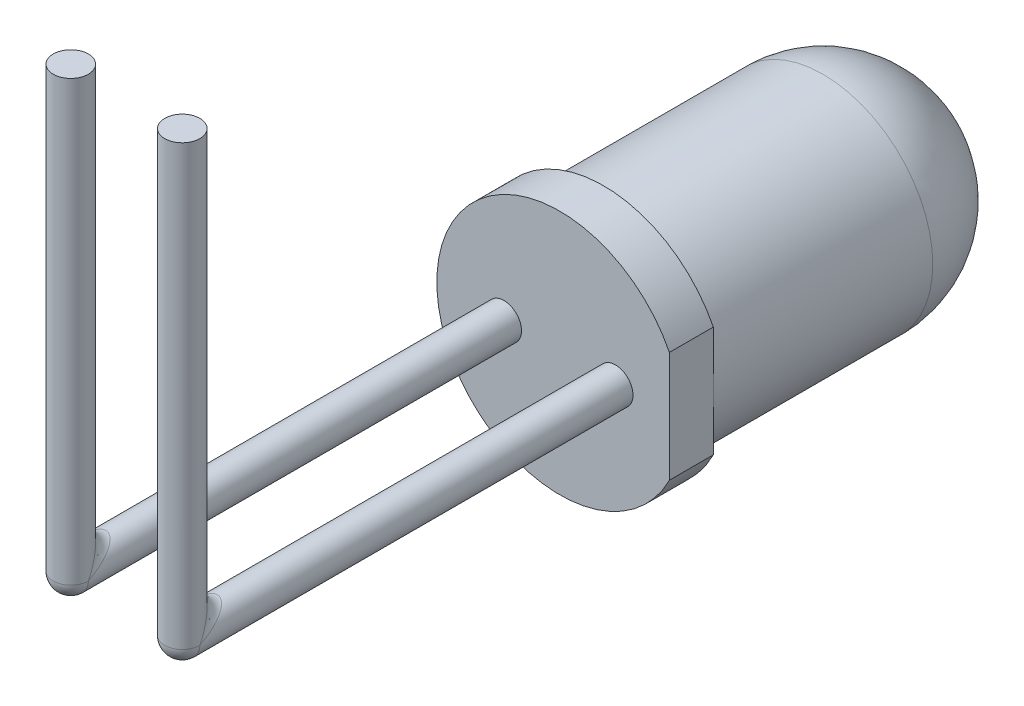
SolidWorks part; units mm, degrees
ref_plane "Face" through (0, 0, 0) normal (0, 0, 1) x (1, 0, 0)
ref_plane "Dessus" through (0, 0, 0) normal (0, 1, 0) x (1, 0, 0)
ref_plane "Droite" through (0, 0, 0) normal (1, 0, 0) x (0, 0, -1)
sketch "Esquisse1" plane through (0, 0, 0) normal (0, 0, 1) x (1, 0, 0)
  circle A0 centre (0, 0) radius 2.5
extrude "Base-Extrusion" add sketch "Esquisse1" along normal blind 8.5
sketch "Esquisse2" plane through (0, 0, 8.5) normal (0, 0, 1) x (1, 0, 0)
  line L0 (2.5, -2.4917) -> (2.5, 2.5621) construction
  line L1 (2.5, 1.261) -> (2.5, -1.261)
  arc A0 (2.5, 1.261) -> (2.5, -1.261) centre (0, 0) ccw
extrude "Boss.-Extru.1" add sketch "Esquisse2" against normal blind 1
fillet "Congé1" radius 2.5 1 edges at (2.5, 0, 0)
sketch "Esquisse3" plane through (0, 0, 8.5) normal (0, 0, 1) x (1, 0, 0)
  line L0 (0, 1.4329) -> (0, -0.9388) construction
  circle A0 centre (1.27, 0) radius 0.4
  circle A1 centre (-1.27, 0) radius 0.4
ref_plane "Plan1" through (0, 0, 0) normal (1, 0, 0) x (0, 0, -1)
sketch "Esquisse4" plane through (0, 0, 0) normal (1, 0, 0) x (0, 0, -1)
  line L0 (-8.5, 0) -> (-18.37, 0)
  line L1 (-8.5, 0.4) -> (-8.5, -0.4) construction
  line L2 (-18.37, 0) -> (-18.37, 10)
  dimension "D1" = 9.87
sweep "Balayage1" add profiles "Esquisse3" path "Esquisse4"
fillet "Congé2" radius 0.4 2 edges at (1.27, 0.4, 17.97) (-1.27, 0.4, 17.97)
